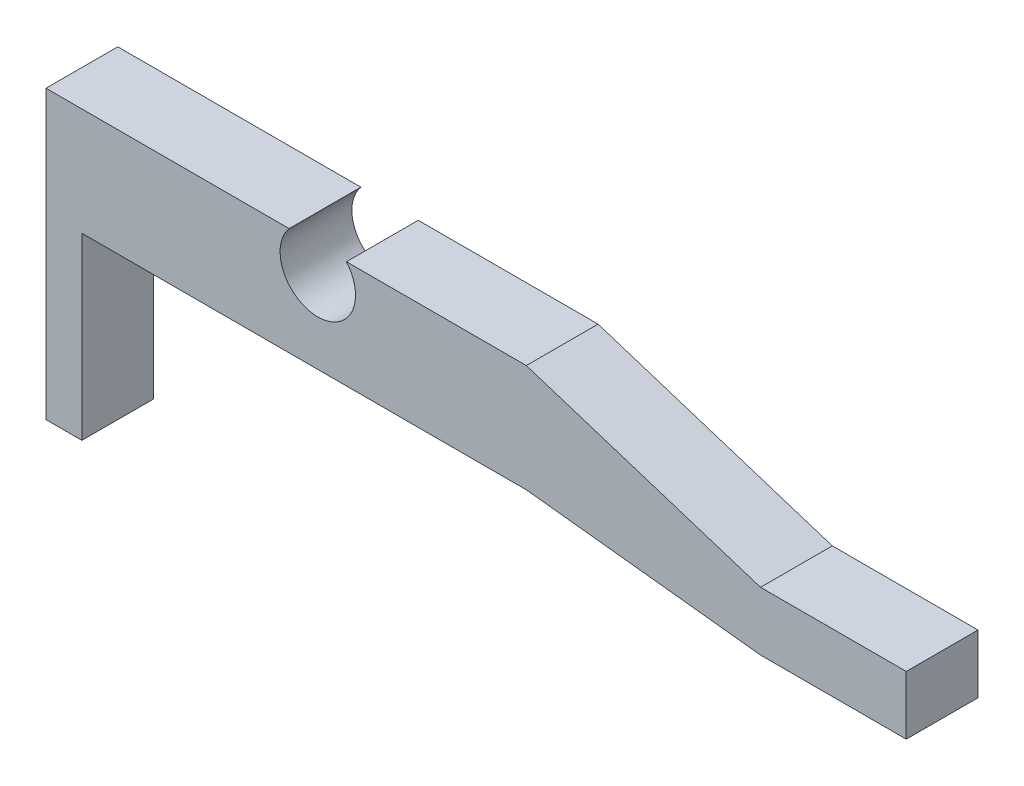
SolidWorks part; units mm, degrees
ref_plane "Ebene vorne" through (0, 0, 0) normal (0, 0, 1) x (1, 0, 0)
ref_plane "Ebene oben" through (0, 0, 0) normal (0, 1, 0) x (1, 0, 0)
ref_plane "Ebene rechts" through (0, 0, 0) normal (1, 0, 0) x (0, 0, -1)
sketch "Skizze1" plane through (0, 0, 0) normal (0, 0, 1) x (1, 0, 0)
  line L0 (-93.7834, 46.3218) -> (-26.017, 46.3218)
  line L1 (40.0985, 46.3218) -> (105.375, 25.4333)
  line L2 (105.375, 25.4333) -> (145.9927, 25.4333)
  line L3 (145.9927, 25.4333) -> (145.9927, 9.0772)
  line L4 (145.9927, 9.0772) -> (105.375, 9.0772)
  line L5 (105.375, 9.0772) -> (40.0985, 16.3218)
  line L6 (40.0985, 16.3218) -> (-83.7834, 16.3218)
  line L7 (-83.7834, 16.3218) -> (-83.7834, -33.6782)
  line L8 (-83.7834, -33.6782) -> (-93.7834, -33.6782)
  line L9 (-93.7834, -33.6782) -> (-93.7834, 46.3218)
  line L10 (-10.0324, 46.3218) -> (40.0985, 46.3218)
  arc A0 (-26.017, 46.3218) -> (-10.0324, 46.3218) centre (-18.0247, 39.4995) ccw
  dimension "D1" = 80
  dimension "D2" = 30
  dimension "D3" = 10
  dimension "D4" = 133.8819
extrude "Aufsatz-Linear austragen1" add sketch "Skizze1" along normal blind 20
